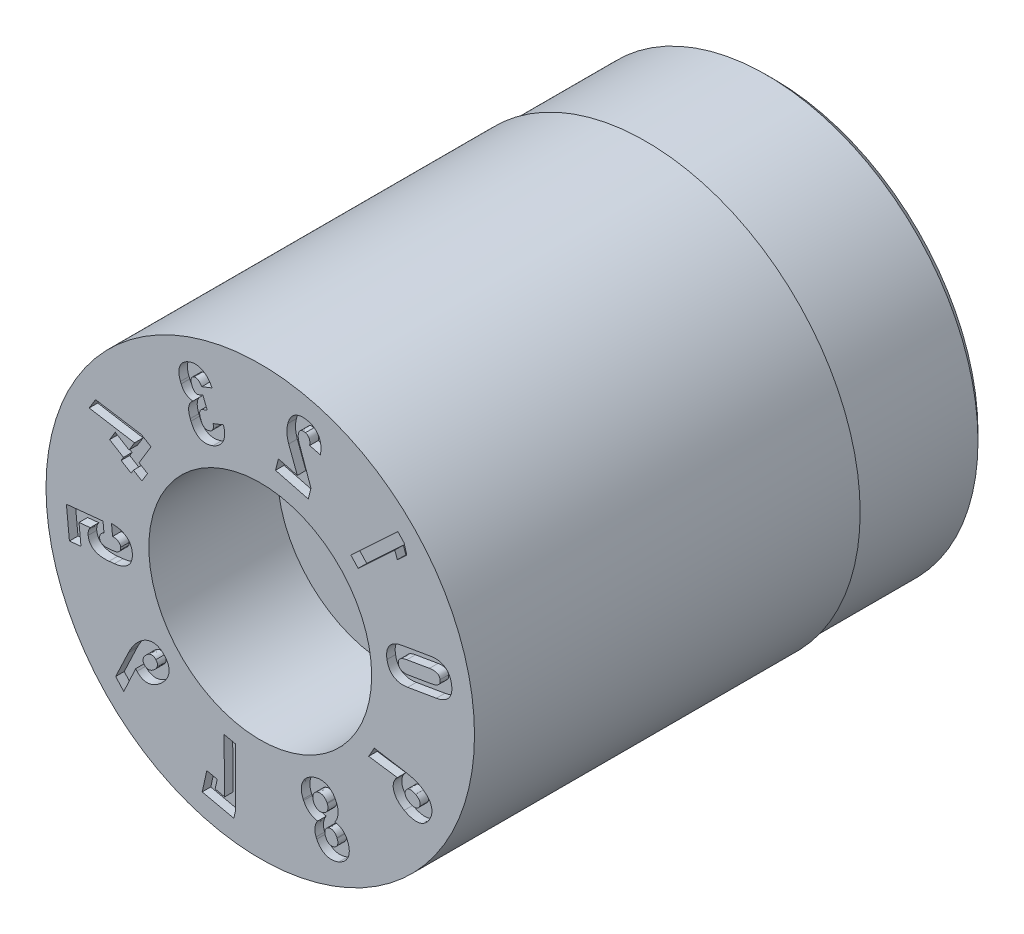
SolidWorks part; units mm, degrees
ref_plane "Front Plane" through (0, 0, 0) normal (0, 0, 1) x (1, 0, 0)
ref_plane "Top Plane" through (0, 0, 0) normal (0, 1, 0) x (1, 0, 0)
ref_plane "Right Plane" through (0, 0, 0) normal (1, 0, 0) x (0, 0, -1)
sketch "Sketch1" plane through (0, 0, 0) normal (1, 0, 0) x (0, 0, -1)
  line L2 (0, 5) -> (0, 2.6)
  line L3 (11.75, 5) -> (0, 5)
  line L4 (-3.7979, 0) -> (49996.2021, 0) construction
  line L8 (12, 1.25) -> (3, 1.25)
  line L9 (3, 2.6) -> (3, 1.25)
  line L10 (3, 2.6) -> (0, 2.6)
  line L12 (12, 1.25) -> (12, 4.75)
  line L16 (12, 4.75) -> (11.75, 5)
  dimension "D1" = 12
  dimension "D2" = 45
  dimension "D3" = 0.25
  dimension "D4" = 10
  dimension "D5" = 5.2
  dimension "D6" = 3
  dimension "D7" = 2.5
revolve "Revolve1" add sketch "Sketch1" angle 360 about L4
sketch "Sketch4" plane through (0, 0, 0) normal (1, 0, 0) x (0, 0, -1)
  line L0 (0, 0) -> (50000, 0) construction
  line L1 (12, -4.75) -> (12, 4.75) construction
  line L2 (9, 5.935) -> (12, 5.935)
  line L3 (9, 5.935) -> (9, 4.935)
  line L4 (9, 4.935) -> (12, 4.935)
  line L5 (12, 5.935) -> (12, 4.935)
  line L6 (11.75, 5) -> (0, 5) construction
  line L9 (0, 5.5) -> (0, -5.5) construction
  dimension "D1" = 1
  dimension "D2" = 0.065
  dimension "D3" = 9
revolve "Cut-Revolve1" cut sketch "Sketch4" angle 360 about L0
sketch "Sketch5" plane through (0, 0, 0) normal (0, 0, 1) x (1, 0, 0)
  line L0 (3.442, 0.1857) -> (4.1115, 0.3001)
  line L1 (3.9783, 1.0816) -> (3.3089, 0.9671)
  line L2 (3.4218, 0.733) -> (3.9494, 0.8231)
  line L3 (3.9987, 0.5339) -> (3.4711, 0.4438)
  line L4 (2.1142, 2.1951) -> (2.2852, 2.0118)
  line L5 (2.2852, 2.0118) -> (3.1397, 2.8083)
  line L6 (3.1397, 2.8083) -> (3.1991, 2.6426)
  line L7 (3.1991, 2.6426) -> (3.4188, 2.8475)
  line L8 (3.4188, 2.8475) -> (3.3576, 3.0617)
  line L9 (3.3576, 3.0617) -> (3.2116, 3.2182)
  line L10 (3.2116, 3.2182) -> (2.1142, 2.1951)
  line L11 (1.1833, 3.0795) -> (0.9098, 3.8516)
  line L12 (0.8923, 4.0455) -> (0.8929, 4.0472)
  line L13 (1.1531, 3.9291) -> (1.1529, 3.9281)
  line L14 (1.1529, 3.9281) -> (1.4024, 3.8641)
  line L15 (1.4024, 3.8641) -> (1.4026, 3.865)
  line L16 (0.6445, 4.1201) -> (0.6442, 4.1189)
  line L17 (0.6641, 3.7147) -> (0.8653, 3.1795)
  line L18 (0.8653, 3.1795) -> (0.4241, 3.2934)
  line L19 (0.4241, 3.2934) -> (0.3559, 3.0287)
  line L20 (0.3559, 3.0287) -> (1.1196, 2.8319)
  line L21 (1.1196, 2.8319) -> (1.1833, 3.0795)
  line L22 (-0.86, 3.3398) -> (-1.1006, 3.2452)
  line L23 (-1.3787, 3.1634) -> (-1.3914, 3.1958)
  line L24 (-1.3432, 3.4056) -> (-1.2388, 3.4469)
  line L25 (-1.2388, 3.4469) -> (-1.338, 3.6992)
  line L26 (-1.338, 3.6992) -> (-1.4424, 3.6579)
  line L27 (-1.5917, 3.7649) -> (-1.601, 3.7888)
  line L28 (-1.3643, 3.8584) -> (-1.1243, 3.9528)
  line L29 (-1.8616, 3.717) -> (-1.8451, 3.6751)
  line L30 (-1.6335, 3.0777) -> (-1.6168, 3.0356)
  line L31 (-2.7707, 2.185) -> (-3.8444, 2.3569)
  line L32 (-3.8444, 2.3569) -> (-3.9922, 2.1139)
  line L33 (-3.9922, 2.1139) -> (-2.9346, 1.9387)
  line L34 (-2.9346, 1.9387) -> (-3.0609, 1.7312)
  line L35 (-3.2461, 1.4269) -> (-3.0137, 1.2857)
  line L36 (-3.0137, 1.2857) -> (-2.9594, 1.375)
  line L37 (-2.5487, 2.05) -> (-2.7707, 2.185)
  line L38 (-3.3846, 1.9282) -> (-3.5152, 1.7133)
  line L39 (-3.5152, 1.7133) -> (-3.1917, 1.5164)
  line L40 (-2.7623, 1.2551) -> (-2.6317, 1.47)
  line L41 (-2.6317, 1.47) -> (-2.8287, 1.5899)
  line L42 (-3.47, 0.0392) -> (-3.4712, 0.0389)
  line L43 (-3.4712, 0.0389) -> (-3.4464, -0.2096)
  line L44 (-3.4464, -0.2096) -> (-3.4452, -0.2094)
  line L45 (-3.4285, -0.4896) -> (-3.5533, -0.5019)
  line L46 (-3.6462, -0.2426) -> (-3.6696, -0.0103)
  line L47 (-3.6696, -0.0103) -> (-4.5243, -0.0961)
  line L48 (-4.5243, -0.0961) -> (-4.4533, -0.8051)
  line L49 (-4.4533, -0.8051) -> (-4.1833, -0.7781)
  line L50 (-4.1833, -0.7781) -> (-4.2295, -0.3177)
  line L51 (-4.2295, -0.3177) -> (-3.9669, -0.2912)
  line L52 (-3.5282, -0.7505) -> (-3.4034, -0.7381)
  line L53 (-2.8283, -2.0262) -> (-2.8293, -2.027)
  line L54 (-3.0758, -2.3726) -> (-3.3743, -3.0032)
  line L55 (-3.3743, -3.0032) -> (-3.1853, -3.2134)
  line L56 (-3.1853, -3.2134) -> (-2.9055, -2.6095)
  line L58 (-2.3138, -2.6078) -> (-2.3131, -2.6073)
  line L59 (-2.4671, -2.4096) -> (-2.4681, -2.4104)
  line L60 (-2.6519, -2.2038) -> (-2.6515, -2.2032)
  line L61 (-0.5758, -4.308) -> (-0.5826, -2.9677)
  line L62 (-0.5826, -2.9677) -> (-0.8463, -2.9091)
  line L63 (-0.8463, -2.9091) -> (-0.8306, -4.1652)
  line L64 (-0.8306, -4.1652) -> (-1.0526, -4.1159)
  line L65 (-1.0526, -4.1159) -> (-1.0037, -3.8962)
  line L66 (-1.0037, -3.8962) -> (-1.2469, -3.8421)
  line L67 (-1.2469, -3.8421) -> (-1.3546, -4.3265)
  line L68 (-1.3546, -4.3265) -> (-0.6164, -4.4905)
  line L69 (-0.6164, -4.4905) -> (-0.5758, -4.308)
  line L70 (1.0018, -3.2931) -> (1.0121, -3.3159)
  line L71 (1.3037, -3.9066) -> (1.3199, -3.9426)
  line L72 (2.0369, -3.6245) -> (2.0208, -3.5886)
  line L73 (1.7786, -2.9759) -> (1.7683, -2.953)
  line L74 (1.5575, -3.0922) -> (1.5636, -3.1055)
  line L75 (1.252, -3.2422) -> (1.2459, -3.228)
  line L76 (1.7886, -3.6792) -> (1.7945, -3.6928)
  line L77 (1.5326, -3.8077) -> (1.5263, -3.7933)
  line L79 (3.36, -2.3399) -> (3.361, -2.3404)
  line L80 (3.7373, -1.6634) -> (3.7366, -1.6628)
  line L81 (3.3363, -1.5435) -> (2.661, -1.4336)
  line L82 (2.661, -1.4336) -> (2.5313, -1.6634)
  line L83 (2.5313, -1.6634) -> (3.1985, -1.7613)
  line L84 (3.6259, -1.8868) -> (3.6266, -1.8874)
  line L85 (3.4901, -2.1267) -> (3.4891, -2.1262)
  line L86 (-3.0609, 1.7312) -> (-3.3846, 1.9282)
  line L87 (-2.8287, 1.5899) -> (-2.5487, 2.05)
  line L88 (-2.9594, 1.375) -> (-2.7623, 1.2551)
  line L89 (-3.1917, 1.5164) -> (-3.2461, 1.4269)
  circle A0 centre (0, 0) radius 3.0592 construction
  spline S0 degree 3 poles (2.9573, 0.505) (2.9628, 0.475) (2.9726, 0.4313) (2.9943, 0.3773) (3.0131, 0.3414) (3.0345, 0.3087) (3.0591, 0.2796) (3.087, 0.2544) (3.1175, 0.2322) (3.1507, 0.2138) (3.186, 0.1987) (3.2236, 0.1877) (3.2634, 0.1799) (3.3052, 0.1758) (3.3652, 0.1752) (3.411, 0.1806) (3.442, 0.1857) knots 0 0 0 0 0.138543 0.202435 0.263663 0.322335 0.379288 0.435991 0.492832 0.550182 0.607806 0.66674 0.727903 0.791223 0.857219 1 1 1 1
  spline S1 degree 3 poles (4.1115, 0.3001) (4.1428, 0.3055) (4.1882, 0.3158) (4.245, 0.3368) (4.2834, 0.3542) (4.3181, 0.3751) (4.3497, 0.3982) (4.3784, 0.4237) (4.403, 0.4524) (4.4244, 0.4832) (4.4421, 0.5165) (4.4554, 0.5522) (4.4651, 0.59) (4.4703, 0.63) (4.4727, 0.6879) (4.4679, 0.7323) (4.4631, 0.7622) knots 0 0 0 0 0.144163 0.210739 0.274358 0.335192 0.394129 0.451737 0.508676 0.565266 0.621864 0.67928 0.737618 0.798403 0.862101 1 1 1 1
  spline S2 degree 3 poles (4.4631, 0.7622) (4.4577, 0.7922) (4.4476, 0.8358) (4.4264, 0.8898) (4.408, 0.9258) (4.3865, 0.9584) (4.3619, 0.9873) (4.3346, 1.013) (4.3045, 1.0352) (4.2715, 1.0534) (4.2364, 1.0686) (4.199, 1.0801) (4.1591, 1.0874) (4.1171, 1.0913) (4.0563, 1.0924) (4.0098, 1.0869) (3.9783, 1.0816) knots 0 0 0 0 0.138378 0.201713 0.262803 0.321406 0.378291 0.434495 0.491006 0.547636 0.60485 0.663987 0.724845 0.788508 0.855017 1 1 1 1
  spline S3 degree 3 poles (3.3089, 0.9671) (3.2776, 0.9617) (3.2321, 0.9514) (3.1753, 0.9304) (3.1369, 0.913) (3.1022, 0.8922) (3.0706, 0.8691) (3.042, 0.8435) (3.0171, 0.8149) (2.9956, 0.7839) (2.9782, 0.7505) (2.9648, 0.7148) (2.9555, 0.6771) (2.9496, 0.6371) (2.9475, 0.5793) (2.952, 0.5349) (2.9573, 0.505) knots 0 0 0 0 0.14414 0.210706 0.274314 0.335139 0.394066 0.451666 0.508997 0.565579 0.622482 0.679237 0.737952 0.79853 0.862217 1 1 1 1
  spline S4 degree 3 poles (3.2248, 0.5506) (3.2208, 0.5726) (3.2211, 0.607) (3.2407, 0.6469) (3.263, 0.6718) (3.2931, 0.6923) (3.3454, 0.7167) (3.39, 0.7276) (3.4218, 0.733) knots 0 0 0 0 0.223205 0.324923 0.432105 0.550245 0.681772 1 1 1 1
  spline S5 degree 3 poles (3.9494, 0.8231) (3.9811, 0.8292) (4.0268, 0.8326) (4.0844, 0.8279) (4.1142, 0.8193) (4.1351, 0.8099) (4.1486, 0.801) (4.1604, 0.7905) (4.1713, 0.7791) (4.1796, 0.7654) (4.1897, 0.7451) (4.1938, 0.7281) (4.196, 0.7165) knots 0 0 0 0 0.317667 0.449746 0.567072 0.621756 0.674782 0.725604 0.7769 0.829516 0.883082 1 1 1 1
  spline S6 degree 3 poles (4.196, 0.7165) (4.1999, 0.6944) (4.1998, 0.6599) (4.1799, 0.6201) (4.1572, 0.5956) (4.1276, 0.5745) (4.075, 0.5504) (4.0305, 0.5393) (3.9987, 0.5339) knots 0 0 0 0 0.223085 0.325467 0.432105 0.549494 0.68195 1 1 1 1
  spline S7 degree 3 poles (3.4711, 0.4438) (3.4394, 0.438) (3.3935, 0.434) (3.336, 0.4394) (3.3061, 0.4478) (3.2856, 0.4575) (3.2721, 0.4661) (3.26, 0.4762) (3.2495, 0.488) (3.2411, 0.5016) (3.231, 0.5219) (3.227, 0.5389) (3.2248, 0.5506) knots 0 0 0 0 0.317973 0.450609 0.568048 0.622069 0.674351 0.725725 0.776685 0.829352 0.882969 1 1 1 1
  spline S8 degree 3 poles (0.9098, 3.8516) (0.8978, 3.8847) (0.8825, 3.9493) (0.885, 4.0157) (0.8923, 4.0455) knots 0 0 0 0 0.535892 1 1 1 1
  spline S9 degree 3 poles (0.8929, 4.0472) (0.8974, 4.065) (0.9073, 4.0903) (0.93, 4.1165) (0.9497, 4.1308) (0.9723, 4.1403) (1.0078, 4.1466) (1.0357, 4.1419) (1.0542, 4.1374) knots 0 0 0 0 0.262368 0.378381 0.490844 0.605686 0.725522 1 1 1 1
  spline S10 degree 3 poles (1.0542, 4.1374) (1.0727, 4.1325) (1.0999, 4.1207) (1.1264, 4.0926) (1.1415, 4.0675) (1.1522, 4.0382) (1.16, 3.9915) (1.1566, 3.9544) (1.1531, 3.9291) knots 0 0 0 0 0.226271 0.335155 0.448129 0.568445 0.698557 1 1 1 1
  spline S11 degree 3 poles (1.4026, 3.865) (1.4112, 3.9083) (1.4185, 3.9725) (1.4155, 4.0563) (1.4063, 4.1137) (1.3914, 4.1672) (1.3696, 4.2162) (1.3424, 4.2606) (1.3091, 4.3) (1.2704, 4.3343) (1.2107, 4.3732) (1.1598, 4.3926) (1.1244, 4.4017) knots 0 0 0 0 0.196017 0.285997 0.371478 0.453744 0.532242 0.608662 0.684325 0.760432 0.837613 1 1 1 1
  spline S12 degree 3 poles (1.1244, 4.4017) (1.0867, 4.4113) (1.0306, 4.4209) (0.957, 4.4193) (0.9067, 4.4113) (0.8595, 4.397) (0.8161, 4.3757) (0.7765, 4.3481) (0.7411, 4.314) (0.7097, 4.2741) (0.6727, 4.211) (0.6545, 4.1573) (0.6445, 4.1201) knots 0 0 0 0 0.184582 0.268007 0.348283 0.425563 0.50122 0.576686 0.653757 0.733643 0.816842 1 1 1 1
  spline S13 degree 3 poles (0.6442, 4.1189) (0.6357, 4.0859) (0.6266, 4.035) (0.6227, 3.9662) (0.6235, 3.914) (0.628, 3.8622) (0.6386, 3.795) (0.6528, 3.7462) (0.6641, 3.7147) knots 0 0 0 0 0.249453 0.375631 0.503311 0.630476 0.755097 1 1 1 1
  spline S14 degree 3 poles (-1.1033, 2.7949) (-1.0676, 2.8089) (-1.017, 2.8348) (-0.9585, 2.8807) (-0.9207, 2.9186) (-0.889, 2.9606) (-0.8639, 3.0065) (-0.8447, 3.0557) (-0.8331, 3.1085) (-0.8278, 3.1638) (-0.8326, 3.2423) (-0.8462, 3.3011) (-0.86, 3.3398) knots 0 0 0 0 0.171989 0.25326 0.332932 0.411461 0.48901 0.567379 0.647707 0.73065 0.816059 1 1 1 1
  spline S15 degree 3 poles (-1.1006, 3.2452) (-1.0969, 3.2312) (-1.0926, 3.2102) (-1.0922, 3.1825) (-1.0936, 3.1634) (-1.0975, 3.1456) (-1.1034, 3.1291) (-1.1107, 3.1136) (-1.1306, 3.085) (-1.1554, 3.0675) (-1.1773, 3.0593) knots 0 0 0 0 0.19613 0.286616 0.372202 0.454148 0.531581 0.608132 0.684137 1 1 1 1
  spline S16 degree 3 poles (-1.1773, 3.0593) (-1.1973, 3.0515) (-1.2285, 3.0441) (-1.2694, 3.0491) (-1.2972, 3.0596) (-1.3221, 3.077) (-1.3539, 3.109) (-1.3693, 3.1412) (-1.3787, 3.1634) knots 0 0 0 0 0.250952 0.364061 0.476788 0.593889 0.716405 1 1 1 1
  spline S17 degree 3 poles (-1.3914, 3.1958) (-1.4004, 3.2194) (-1.4117, 3.2542) (-1.4148, 3.3001) (-1.4112, 3.3293) (-1.4027, 3.3553) (-1.3829, 3.3849) (-1.3599, 3.3995) (-1.3432, 3.4056) knots 0 0 0 0 0.313559 0.445896 0.56566 0.675483 0.780224 1 1 1 1
  spline S18 degree 3 poles (-1.4424, 3.6579) (-1.4559, 3.6527) (-1.4782, 3.6489) (-1.5066, 3.6573) (-1.5269, 3.6686) (-1.5456, 3.6857) (-1.5705, 3.7163) (-1.5833, 3.745) (-1.5917, 3.7649) knots 0 0 0 0 0.212794 0.315516 0.426436 0.548884 0.682941 1 1 1 1
  spline S19 degree 3 poles (-1.601, 3.7888) (-1.6083, 3.8078) (-1.6172, 3.8362) (-1.6178, 3.8736) (-1.6139, 3.8978) (-1.6051, 3.9194) (-1.5865, 3.9443) (-1.5663, 3.9571) (-1.5514, 3.9624) knots 0 0 0 0 0.301459 0.428676 0.547274 0.659179 0.767261 1 1 1 1
  spline S20 degree 3 poles (-1.5514, 3.9624) (-1.5412, 3.9665) (-1.5251, 3.9707) (-1.5031, 3.9699) (-1.4865, 3.9675) (-1.4699, 3.9623) (-1.4538, 3.9543) (-1.4377, 3.9442) (-1.4219, 3.9316) (-1.4064, 3.9168) (-1.3862, 3.8929) (-1.3725, 3.8729) (-1.3643, 3.8584) knots 0 0 0 0 0.140426 0.209784 0.28147 0.355272 0.43104 0.512244 0.598245 0.689934 0.786784 1 1 1 1
  spline S21 degree 3 poles (-1.1243, 3.9528) (-1.1434, 3.9914) (-1.1753, 4.0463) (-1.2286, 4.109) (-1.2702, 4.1486) (-1.3145, 4.1815) (-1.3609, 4.2075) (-1.4091, 4.2262) (-1.4587, 4.2381) (-1.5092, 4.2426) (-1.5776, 4.2396) (-1.6277, 4.2259) (-1.6599, 4.2135) knots 0 0 0 0 0.19587 0.286195 0.3729 0.456212 0.535961 0.613567 0.690311 0.766664 0.843152 1 1 1 1
  spline S22 degree 3 poles (-1.6599, 4.2135) (-1.6858, 4.2035) (-1.7229, 4.186) (-1.7673, 4.1567) (-1.7965, 4.1335) (-1.8221, 4.1081) (-1.8439, 4.0806) (-1.8625, 4.0512) (-1.8774, 4.0197) (-1.8887, 3.9864) (-1.8967, 3.9519) (-1.8997, 3.9159) (-1.9003, 3.8786) (-1.8961, 3.84) (-1.886, 3.785) (-1.872, 3.7443) (-1.8616, 3.717) knots 0 0 0 0 0.13708 0.200603 0.261411 0.320082 0.377351 0.433878 0.491019 0.548417 0.606105 0.665038 0.725663 0.789312 0.855771 1 1 1 1
  spline S23 degree 3 poles (-1.8451, 3.6751) (-1.833, 3.6449) (-1.8111, 3.6016) (-1.7701, 3.5535) (-1.7363, 3.5234) (-1.6991, 3.4989) (-1.6445, 3.4748) (-1.6, 3.4667) (-1.5699, 3.4656) knots 0 0 0 0 0.266463 0.391489 0.514435 0.635394 0.754012 1 1 1 1
  spline S24 degree 3 poles (-1.5699, 3.4656) (-1.5826, 3.456) (-1.6014, 3.4408) (-1.6211, 3.4161) (-1.635, 3.3971) (-1.6457, 3.3761) (-1.6551, 3.3542) (-1.6621, 3.3307) (-1.667, 3.306) (-1.67, 3.2802) (-1.6714, 3.2536) (-1.6699, 3.2261) (-1.6672, 3.1979) (-1.6618, 3.1688) (-1.6518, 3.1282) (-1.641, 3.0981) (-1.6335, 3.0777) knots 0 0 0 0 0.113019 0.168119 0.223243 0.278028 0.334008 0.391337 0.450581 0.511785 0.574305 0.638549 0.705255 0.774444 0.846844 1 1 1 1
  spline S25 degree 3 poles (-1.6168, 3.0356) (-1.6023, 2.9977) (-1.5756, 2.9448) (-1.5308, 2.8826) (-1.494, 2.8446) (-1.4544, 2.8129) (-1.4114, 2.7885) (-1.3655, 2.7715) (-1.3169, 2.7614) (-1.266, 2.7591) (-1.1932, 2.7647) (-1.1391, 2.7815) (-1.1033, 2.7949) knots 0 0 0 0 0.188755 0.274214 0.355785 0.433979 0.509562 0.584843 0.661022 0.739492 0.821174 1 1 1 1
  spline S26 degree 3 poles (-2.9868, -0.303) (-2.9899, -0.2689) (-3.0013, -0.219) (-3.0299, -0.1578) (-3.0576, -0.1162) (-3.0911, -0.0786) (-3.1306, -0.0459) (-3.1755, -0.0178) (-3.226, 0.0048) (-3.281, 0.0224) (-3.3624, 0.0387) (-3.4265, 0.0406) (-3.47, 0.0392) knots 0 0 0 0 0.155803 0.230724 0.306258 0.382544 0.459108 0.539155 0.622836 0.710051 0.801708 1 1 1 1
  spline S27 degree 3 poles (-3.4452, -0.2094) (-3.4203, -0.2093) (-3.3842, -0.2118) (-3.3405, -0.2262) (-3.3135, -0.2404) (-3.2909, -0.2583) (-3.268, -0.2881) (-3.26, -0.3156) (-3.2581, -0.3341) knots 0 0 0 0 0.300284 0.430614 0.55179 0.666055 0.775303 1 1 1 1
  spline S28 degree 3 poles (-3.2581, -0.3341) (-3.2557, -0.3539) (-3.2587, -0.3839) (-3.2762, -0.4192) (-3.2963, -0.441) (-3.3214, -0.4597) (-3.3652, -0.4798) (-3.4024, -0.4868) (-3.4285, -0.4896) knots 0 0 0 0 0.229577 0.337415 0.448974 0.568228 0.696394 1 1 1 1
  spline S29 degree 3 poles (-3.5533, -0.5019) (-3.5794, -0.5048) (-3.6171, -0.5053) (-3.6638, -0.4964) (-3.6919, -0.4847) (-3.715, -0.4691) (-3.7387, -0.4419) (-3.7468, -0.4157) (-3.7486, -0.398) knots 0 0 0 0 0.316774 0.450543 0.570862 0.681251 0.784142 1 1 1 1
  spline S30 degree 3 poles (-3.7486, -0.398) (-3.7504, -0.3811) (-3.7491, -0.356) (-3.7392, -0.3243) (-3.7276, -0.303) (-3.7123, -0.2838) (-3.6867, -0.2608) (-3.6627, -0.2491) (-3.6462, -0.2426) knots 0 0 0 0 0.251599 0.369678 0.490202 0.610726 0.733695 1 1 1 1
  spline S31 degree 3 poles (-3.9669, -0.2912) (-3.9767, -0.302) (-3.9885, -0.321) (-4.0007, -0.3492) (-4.0154, -0.3963) (-4.0185, -0.4383) (-4.0157, -0.4712) knots 0 0 0 0 0.226849 0.349811 0.481607 1 1 1 1
  spline S32 degree 3 poles (-4.0157, -0.4712) (-4.0129, -0.5034) (-4.0016, -0.5502) (-3.9733, -0.6063) (-3.9459, -0.6428) (-3.9122, -0.6743) (-3.8729, -0.7009) (-3.8281, -0.7226) (-3.7776, -0.7386) (-3.722, -0.7496) (-3.6382, -0.7579) (-3.5728, -0.7547) (-3.5282, -0.7505) knots 0 0 0 0 0.152893 0.224939 0.295882 0.367837 0.441812 0.519525 0.602637 0.691634 0.78754 1 1 1 1
  spline S33 degree 3 poles (-3.4034, -0.7381) (-3.3587, -0.7337) (-3.2939, -0.7225) (-3.2142, -0.6943) (-3.1623, -0.6688) (-3.1162, -0.6387) (-3.0768, -0.6033) (-3.044, -0.5634) (-3.0182, -0.5191) (-2.9992, -0.4705) (-2.9829, -0.3984) (-2.9831, -0.3414) (-2.9868, -0.303) knots 0 0 0 0 0.19759 0.286634 0.370863 0.45097 0.527796 0.602228 0.676703 0.752419 0.830526 1 1 1 1
  spline S34 degree 3 poles (-2.2336, -2.0129) (-2.259, -1.9844) (-2.3008, -1.9467) (-2.3643, -1.9104) (-2.4124, -1.8916) (-2.4621, -1.8809) (-2.513, -1.8774) (-2.5649, -1.8832) (-2.6177, -1.8961) (-2.6707, -1.9175) (-2.7445, -1.9566) (-2.7954, -1.9967) (-2.8283, -2.0262) knots 0 0 0 0 0.169643 0.247739 0.323778 0.398511 0.472865 0.54971 0.629664 0.713946 0.803019 1 1 1 1
  spline S35 degree 3 poles (-2.8293, -2.027) (-2.8499, -2.0457) (-2.8801, -2.0757) (-2.9177, -2.1194) (-2.9749, -2.1925) (-3.0169, -2.2587) (-3.0466, -2.3142) knots 0 0 0 0 0.230728 0.352138 0.477792 1 1 1 1
  spline S36 degree 3 poles (-3.0466, -2.3142) (-3.0516, -2.324) (-3.0623, -2.3429) (-3.0713, -2.3628) (-3.0758, -2.3726) knots 0 0 0 0 0.504098 1 1 1 1
  spline S37 degree 3 poles (-2.9055, -2.6095) (-2.8976, -2.6237) (-2.8879, -2.637) (-2.877, -2.6491) knots 0.765471 0.765471 0.765471 0.765471 1 1 1 1
  spline S38 degree 3 poles (-2.877, -2.6491) (-2.8542, -2.6746) (-2.8161, -2.708) (-2.7579, -2.7391) (-2.7131, -2.7544) (-2.6665, -2.7621) (-2.6185, -2.762) (-2.5693, -2.7547) (-2.519, -2.7397) (-2.4679, -2.7174) (-2.3965, -2.6767) (-2.3463, -2.6371) (-2.3138, -2.6078) knots 0 0 0 0 0.160689 0.234959 0.308542 0.381866 0.455939 0.532986 0.614723 0.70148 0.794412 1 1 1 1
  spline S39 degree 3 poles (-2.3131, -2.6073) (-2.28, -2.5772) (-2.2343, -2.5304) (-2.1867, -2.4607) (-2.1594, -2.4097) (-2.1403, -2.3582) (-2.1289, -2.3067) (-2.1265, -2.2553) (-2.1315, -2.2044) (-2.145, -2.1543) (-2.1746, -2.0871) (-2.208, -2.0413) (-2.2336, -2.0129) knots 0 0 0 0 0.197426 0.286668 0.371343 0.451538 0.528337 0.603022 0.677386 0.752893 0.83096 1 1 1 1
  spline S40 degree 3 poles (-2.4354, -2.1944) (-2.4222, -2.2094) (-2.4051, -2.2344) (-2.3974, -2.2725) (-2.3982, -2.3005) (-2.4057, -2.3289) (-2.4263, -2.3678) (-2.4492, -2.3937) (-2.4671, -2.4096) knots 0 0 0 0 0.245103 0.355627 0.467498 0.584048 0.70879 1 1 1 1
  spline S41 degree 3 poles (-2.4681, -2.4104) (-2.4885, -2.4288) (-2.5201, -2.4527) (-2.5657, -2.4729) (-2.5972, -2.4798) (-2.6272, -2.4797) (-2.6658, -2.4696) (-2.69, -2.4507) (-2.7035, -2.4357) knots 0 0 0 0 0.308282 0.43931 0.557169 0.6674 0.772658 1 1 1 1
  spline S42 degree 3 poles (-2.7035, -2.4357) (-2.7172, -2.421) (-2.7326, -2.3946) (-2.7384, -2.3552) (-2.7349, -2.325) (-2.7243, -2.2943) (-2.6995, -2.2507) (-2.672, -2.2223) (-2.6519, -2.2038) knots 0 0 0 0 0.224997 0.331057 0.441807 0.562303 0.692733 1 1 1 1
  spline S43 degree 3 poles (-2.6515, -2.2032) (-2.6338, -2.1872) (-2.6059, -2.1666) (-2.5648, -2.1511) (-2.5361, -2.1464) (-2.5081, -2.1489) (-2.4713, -2.1602) (-2.4488, -2.1801) (-2.4354, -2.1944) knots 0 0 0 0 0.29328 0.416999 0.534274 0.646454 0.757164 1 1 1 1
  spline S44 degree 3 poles (1.2155, -2.7411) (1.1794, -2.7571) (1.1285, -2.7861) (1.0704, -2.8357) (1.0343, -2.8766) (1.005, -2.921) (0.9819, -2.9682) (0.9671, -3.0187) (0.9588, -3.0713) (0.9584, -3.1257) (0.9671, -3.2015) (0.9863, -3.2569) (1.0018, -3.2931) knots 0 0 0 0 0.177852 0.26148 0.342613 0.422344 0.500227 0.578341 0.657795 0.738986 0.822462 1 1 1 1
  spline S45 degree 3 poles (1.0121, -3.3159) (1.027, -3.3496) (1.0554, -3.3975) (1.1052, -3.4522) (1.1473, -3.4885) (1.1928, -3.5192) (1.2564, -3.5506) (1.3078, -3.5627) (1.3422, -3.5661) knots 0 0 0 0 0.254903 0.381809 0.510932 0.638527 0.761102 1 1 1 1
  spline S46 degree 3 poles (1.3422, -3.5661) (1.3245, -3.5896) (1.3021, -3.6284) (1.2848, -3.6855) (1.2766, -3.7302) (1.2743, -3.7758) (1.2784, -3.836) (1.2921, -3.8792) (1.3037, -3.9066) knots 0 0 0 0 0.245951 0.369856 0.497299 0.625719 0.750477 1 1 1 1
  spline S47 degree 3 poles (1.3199, -3.9426) (1.3349, -3.9767) (1.3623, -4.0246) (1.4093, -4.0792) (1.4479, -4.1132) (1.4896, -4.1411) (1.5341, -4.1627) (1.5814, -4.1768) (1.6309, -4.1848) (1.682, -4.1858) (1.753, -4.1773) (1.805, -4.1599) (1.8388, -4.145) knots 0 0 0 0 0.178326 0.261809 0.343693 0.423509 0.501235 0.579289 0.658911 0.740109 0.823002 1 1 1 1
  spline S48 degree 3 poles (1.8388, -4.145) (1.873, -4.1304) (1.9202, -4.1026) (1.9747, -4.0561) (2.0082, -4.0174) (2.0359, -3.9757) (2.0563, -3.9307) (2.0707, -3.8834) (2.078, -3.8337) (2.0784, -3.7823) (2.0691, -3.711) (2.0522, -3.6585) (2.0369, -3.6245) knots 0 0 0 0 0.17724 0.260221 0.341607 0.420996 0.49913 0.576726 0.656865 0.738321 0.821932 1 1 1 1
  spline S49 degree 3 poles (2.0208, -3.5886) (2.0084, -3.5609) (1.9849, -3.5214) (1.9426, -3.4777) (1.9072, -3.4487) (1.8681, -3.4253) (1.8138, -3.4004) (1.7697, -3.3919) (1.7405, -3.3895) knots 0 0 0 0 0.25238 0.37731 0.504615 0.631437 0.755258 1 1 1 1
  spline S50 degree 3 poles (1.7405, -3.3895) (1.7615, -3.3616) (1.7867, -3.3146) (1.8067, -3.2461) (1.815, -3.1917) (1.8168, -3.1363) (1.8095, -3.0628) (1.7937, -3.0095) (1.7786, -2.9759) knots 0 0 0 0 0.240868 0.364207 0.491227 0.619493 0.745982 1 1 1 1
  spline S51 degree 3 poles (1.7683, -2.953) (1.7522, -2.917) (1.7236, -2.8659) (1.6736, -2.8083) (1.6329, -2.7722) (1.5886, -2.7427) (1.5409, -2.7208) (1.4907, -2.7052) (1.4379, -2.6974) (1.3833, -2.6971) (1.3073, -2.7063) (1.2517, -2.7253) (1.2155, -2.7411) knots 0 0 0 0 0.177776 0.260857 0.341955 0.421652 0.499327 0.577213 0.656885 0.738345 0.82213 1 1 1 1
  spline S52 degree 3 poles (1.3264, -2.9906) (1.341, -2.9841) (1.3636, -2.977) (1.3947, -2.9742) (1.4173, -2.9753) (1.4392, -2.98) (1.4605, -2.9871) (1.4804, -2.9979) (1.4992, -3.0116) (1.5163, -3.0281) (1.5381, -3.0537) (1.5502, -3.0764) (1.5575, -3.0922) knots 0 0 0 0 0.16908 0.248383 0.328828 0.407558 0.484814 0.564788 0.646065 0.730145 0.816095 1 1 1 1
  spline S53 degree 3 poles (1.5636, -3.1055) (1.5699, -3.1202) (1.5773, -3.1427) (1.581, -3.1733) (1.5807, -3.1952) (1.577, -3.2165) (1.5711, -3.2371) (1.5619, -3.2563) (1.5502, -3.2744) (1.5356, -3.2909) (1.5122, -3.3112) (1.4915, -3.323) (1.4768, -3.3294) knots 0 0 0 0 0.177813 0.260402 0.341396 0.420793 0.499738 0.577761 0.656811 0.738277 0.821492 1 1 1 1
  spline S54 degree 3 poles (1.4768, -3.3294) (1.4622, -3.3362) (1.4397, -3.3434) (1.409, -3.3472) (1.387, -3.3468) (1.3656, -3.3437) (1.3451, -3.3372) (1.3257, -3.328) (1.3077, -3.3157) (1.2909, -3.3011) (1.2706, -3.2774) (1.2583, -3.257) (1.252, -3.2422) knots 0 0 0 0 0.177489 0.2597 0.340322 0.419971 0.498076 0.57682 0.656453 0.738672 0.822624 1 1 1 1
  spline S55 degree 3 poles (1.2459, -3.228) (1.2384, -3.2123) (1.2309, -3.1878) (1.226, -3.1548) (1.2256, -3.131) (1.2284, -3.1082) (1.2339, -3.0863) (1.2428, -3.066) (1.2544, -3.0471) (1.2687, -3.0299) (1.2916, -3.0091) (1.3118, -2.9969) (1.3264, -2.9906) knots 0 0 0 0 0.184565 0.27082 0.355255 0.436218 0.515796 0.593669 0.671972 0.75123 0.830786 1 1 1 1
  spline S56 degree 3 poles (1.5886, -3.581) (1.601, -3.5761) (1.6202, -3.5691) (1.6467, -3.5681) (1.666, -3.5696) (1.6847, -3.5741) (1.7027, -3.5817) (1.7202, -3.5916) (1.7366, -3.6045) (1.7518, -3.62) (1.771, -3.6439) (1.7819, -3.6648) (1.7886, -3.6792) knots 0 0 0 0 0.162044 0.239793 0.316517 0.393057 0.469567 0.549605 0.632905 0.719784 0.80896 1 1 1 1
  spline S57 degree 3 poles (1.7945, -3.6928) (1.8004, -3.7064) (1.8077, -3.7272) (1.8123, -3.7554) (1.8126, -3.7756) (1.8105, -3.7951) (1.8053, -3.8134) (1.7986, -3.8309) (1.7889, -3.8471) (1.7768, -3.8617) (1.7578, -3.8799) (1.7401, -3.8897) (1.7278, -3.8953) knots 0 0 0 0 0.18617 0.273106 0.356916 0.438209 0.516824 0.594201 0.672142 0.75121 0.830441 1 1 1 1
  spline S58 degree 3 poles (1.7278, -3.8953) (1.7154, -3.9005) (1.6963, -3.9074) (1.6701, -3.909) (1.6511, -3.9082) (1.6328, -3.9042) (1.615, -3.8981) (1.5985, -3.8886) (1.5824, -3.8772) (1.5678, -3.8629) (1.5493, -3.8407) (1.5389, -3.8212) (1.5326, -3.8077) knots 0 0 0 0 0.16891 0.24796 0.326508 0.404489 0.481377 0.559627 0.641394 0.726526 0.813818 1 1 1 1
  spline S59 degree 3 poles (1.5263, -3.7933) (1.52, -3.7789) (1.5121, -3.7572) (1.5073, -3.7274) (1.5065, -3.7061) (1.5079, -3.6855) (1.5122, -3.666) (1.5187, -3.6476) (1.5283, -3.6308) (1.5397, -3.6152) (1.5588, -3.5967) (1.5762, -3.5864) (1.5886, -3.581) knots 0 0 0 0 0.189172 0.277572 0.363717 0.446171 0.525537 0.603914 0.680927 0.7588 0.836478 1 1 1 1
  spline S60 degree 3 poles (3.1985, -1.7613) (3.1975, -1.7621) (3.1898, -1.7691) (3.1691, -1.791) (3.1524, -1.8145) (3.143, -1.8317) knots 0.574093 0.574093 0.574093 0.574093 0.592802 0.721438 1 1 1 1
  spline S61 degree 3 poles (3.143, -1.8317) (3.1272, -1.8592) (3.1093, -1.9034) (3.1014, -1.9654) (3.1028, -2.0118) (3.1116, -2.058) (3.1271, -2.1037) (3.1504, -2.1479) (3.1797, -2.1914) (3.2161, -2.2326) (3.2734, -2.2865) (3.3245, -2.3192) (3.36, -2.3399) knots 0 0 0 0 0.153674 0.227489 0.301797 0.377752 0.454571 0.534764 0.619335 0.708083 0.800481 1 1 1 1
  spline S62 degree 3 poles (3.361, -2.3404) (3.4001, -2.3628) (3.4597, -2.3909) (3.5414, -2.4144) (3.5986, -2.424) (3.6536, -2.4263) (3.706, -2.4202) (3.7557, -2.4073) (3.8021, -2.3858) (3.8453, -2.3572) (3.8994, -2.3077) (3.9322, -2.2619) (3.9508, -2.2284) knots 0 0 0 0 0.198763 0.288254 0.373192 0.453554 0.530019 0.604256 0.678749 0.754163 0.831392 1 1 1 1
  spline S63 degree 3 poles (3.9508, -2.2284) (3.9695, -2.1952) (3.992, -2.1435) (4.0055, -2.0716) (4.0074, -2.0197) (4.0012, -1.9687) (3.9866, -1.919) (3.9638, -1.871) (3.9335, -1.8246) (3.8953, -1.7802) (3.8323, -1.7223) (3.7767, -1.6861) (3.7373, -1.6634) knots 0 0 0 0 0.167046 0.244195 0.319353 0.393688 0.468511 0.54527 0.625669 0.710728 0.800868 1 1 1 1
  spline S64 degree 3 poles (3.7366, -1.6628) (3.7138, -1.6502) (3.6778, -1.6323) (3.6267, -1.6131) (3.5854, -1.5989) (3.5414, -1.5866) (3.4783, -1.5703) (3.4291, -1.5603) (3.3956, -1.5541) knots 0 0 0 0 0.21781 0.334168 0.45547 0.581845 0.71535 1 1 1 1
  spline S65 degree 3 poles (3.3956, -1.5541) (3.3857, -1.552) (3.3661, -1.5476) (3.3462, -1.5445) (3.3363, -1.5435) knots 0 0 0 0 0.506174 1 1 1 1
  spline S66 degree 3 poles (3.3982, -1.9161) (3.4079, -1.8988) (3.4272, -1.8755) (3.4619, -1.857) (3.4906, -1.8502) (3.5218, -1.8496) (3.5687, -1.8587) (3.6031, -1.8739) (3.6259, -1.8868) knots 0 0 0 0 0.230405 0.339057 0.450208 0.56854 0.697226 1 1 1 1
  spline S67 degree 3 poles (3.6266, -1.8874) (3.6484, -1.8998) (3.6786, -1.9201) (3.7083, -1.9552) (3.723, -1.9816) (3.7313, -2.0093) (3.732, -2.0482) (3.7223, -2.0765) (3.7122, -2.0936) knots 0 0 0 0 0.298302 0.425565 0.542981 0.654467 0.764427 1 1 1 1
  spline S68 degree 3 poles (3.7122, -2.0936) (3.7022, -2.1107) (3.6837, -2.135) (3.6491, -2.1536) (3.6211, -2.161) (3.5906, -2.1617) (3.545, -2.1545) (3.5119, -2.1389) (3.4901, -2.1267) knots 0 0 0 0 0.236925 0.346414 0.457866 0.576251 0.703376 1 1 1 1
  spline S69 degree 3 poles (3.4891, -2.1262) (3.4663, -2.1135) (3.4353, -2.0921) (3.4039, -2.0563) (3.3885, -2.0293) (3.3796, -2.0014) (3.3782, -1.962) (3.3885, -1.9335) (3.3982, -1.9161) knots 0 0 0 0 0.302837 0.430945 0.549067 0.659888 0.767687 1 1 1 1
  dimension "D1" = 6.1184
extrude "Cut-Extrude1" cut sketch "Sketch5" against normal blind 0.2
